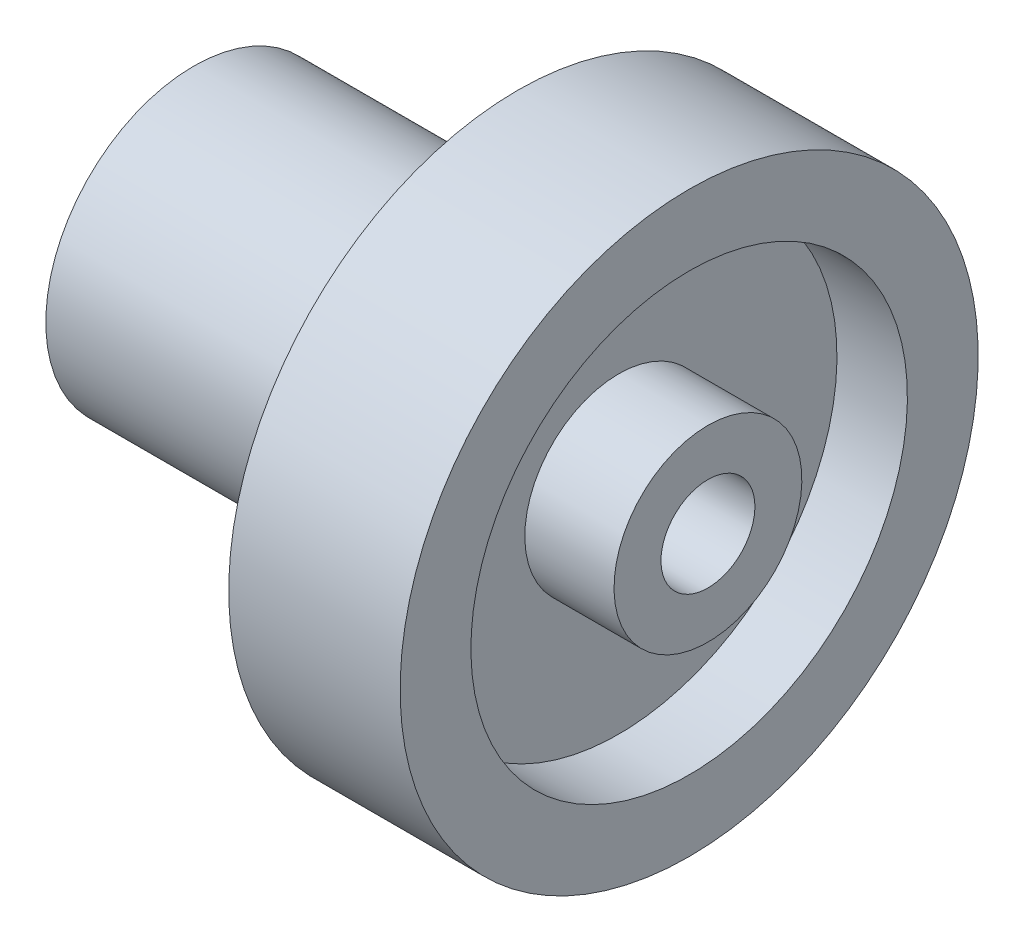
SolidWorks part; units mm, degrees
ref_plane "Plan1" through (0, 0, 0) normal (0, 0, 1) x (1, 0, 0)
ref_plane "Plan2" through (0, 0, 0) normal (0, 1, 0) x (1, 0, 0)
ref_plane "Plan3" through (0, 0, 0) normal (1, 0, 0) x (0, 0, -1)
sketch "Esquisse1" plane through (0, 0, 0) normal (0, 0, 1) x (1, 0, 0)
  line L0 (24.2282, 16.6843) -> (1.3282, 16.6843)
  line L1 (1.3282, 16.6843) -> (1.3282, 18.8163)
  line L2 (1.3282, 18.8163) -> (2.3282, 19.0843)
  line L3 (2.3282, 19.0843) -> (2.3282, 20.9843)
  line L4 (2.3282, 20.9843) -> (18.4282, 20.9843)
  line L5 (18.4282, 20.9843) -> (18.4282, 23.4943)
  line L6 (18.4282, 23.4943) -> (16.1282, 24.2943)
  line L7 (16.1282, 24.2943) -> (16.1282, 26.9943)
  line L8 (16.1282, 26.9943) -> (23.4282, 26.9943)
  line L9 (23.4282, 26.9943) -> (23.4282, 23.9798)
  line L10 (23.4282, 23.9798) -> (20.4282, 23.9798)
  line L11 (20.4282, 23.9798) -> (20.4282, 18.6843)
  line L12 (20.4282, 18.6843) -> (24.2282, 18.6843)
  line L13 (24.2282, 18.6843) -> (24.2282, 16.6843)
  line L14 (1.3282, 18.8163) -> (10.1289, 18.8163) construction
  line L15 (52.6668, 14.6843) -> (-29.5035, 14.6843) construction
  dimension "D1" = 7.3
  dimension "D2" = 16.1
  dimension "D3" = 22.9
  dimension "D4" = 3.8
  dimension "D5" = 2.132
  dimension "D6" = 12.31
  dimension "D7" = 2
  dimension "D8" = 3
  dimension "D9" = 4.4
  dimension "D10" = 2.3
  dimension "D11" = 0.8
  dimension "D12" = 2.7
  dimension "D13" = 6.3
  dimension "D14" = 3.0145
  dimension "D15" = 2
revolve "Base-Révolution" add sketch "Esquisse1" angle 360 about L15
